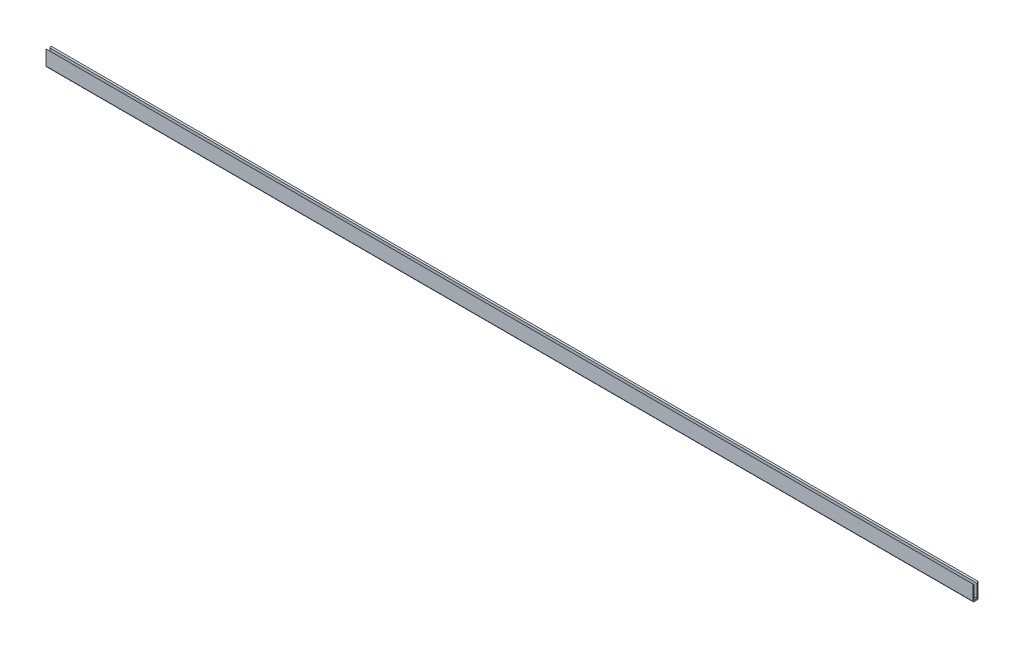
SolidWorks part; units mm, degrees
ref_plane "正面" through (0, 0, 0) normal (0, 0, 1) x (1, 0, 0)
ref_plane "平面" through (0, 0, 0) normal (0, 1, 0) x (1, 0, 0)
ref_plane "右側面" through (0, 0, 0) normal (1, 0, 0) x (0, 0, -1)
sketch "ｽｹｯﾁ2" plane through (0, 0, 0) normal (1, 0, 0) x (0, 0, -1)
  line L94 (-1.5, 15.85) -> (-1.5, 1.5)
  line L95 (1.5, 15.85) -> (1.5, 1.5)
  line L96 (2.65, 17) -> (2.65, 1)
  line L97 (-2.65, 17) -> (-2.65, 1)
  line L98 (-1.5, 1.5) -> (1.5, 1.5)
  line L99 (-1.65, 0) -> (1.65, 0)
  line L100 (-2.65, 17) -> (-1.5, 15.85)
  line L101 (2.65, 17) -> (1.5, 15.85)
  arc A94 (1.65, 0) -> (2.65, 1) centre (1.65, 1) ccw
  arc A95 (-2.65, 1) -> (-1.65, 0) centre (-1.65, 1) ccw
extrude "押し出し1" add sketch "ｽｹｯﾁ2" along normal blind 1000
